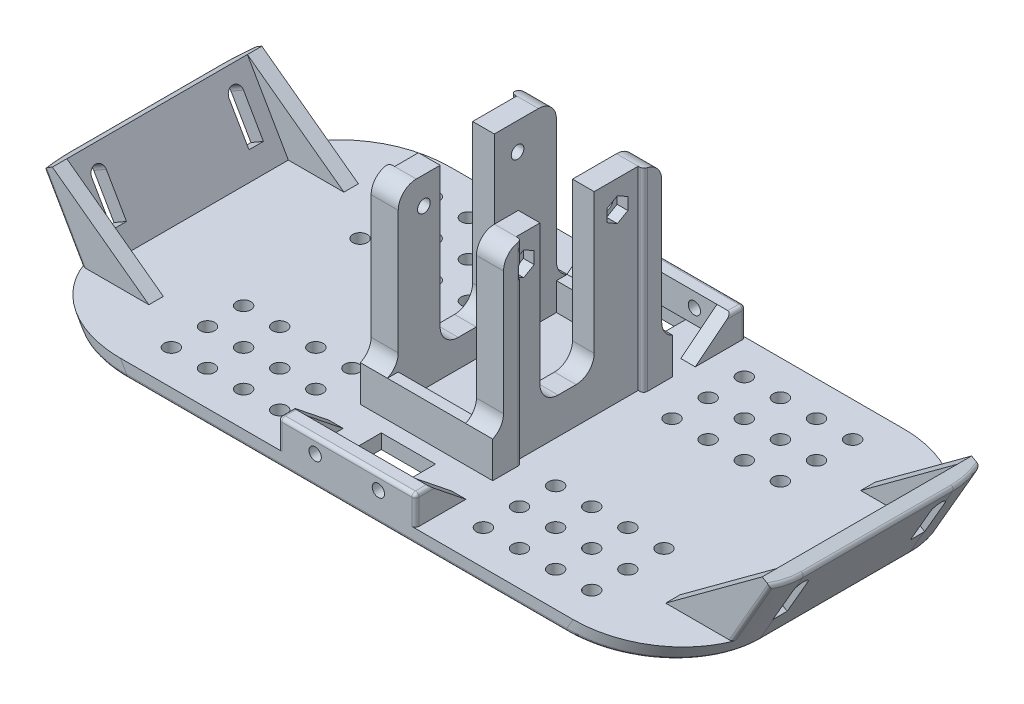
SolidWorks part; units mm, degrees
ref_plane "前视基准面" through (0, 0, 0) normal (0, 0, 1) x (1, 0, 0)
ref_plane "上视基准面" through (0, 0, 0) normal (0, 1, 0) x (1, 0, 0)
ref_plane "右视基准面" through (0, 0, 0) normal (1, 0, 0) x (0, 0, -1)
sketch "草图1" plane through (0, 0, 0) normal (0, 0, 1) x (1, 0, 0)
  line L0 (0, 38.1234) -> (0, -105.8805) construction
  line L1 (-100, -37.7728) -> (100, -37.7728)
  line L2 (-100, -37.7728) -> (-100, -33.7728)
  line L3 (-100, -33.7728) -> (100, -33.7728)
  line L4 (100, -37.7728) -> (100, -33.7728)
  circle A1 centre (-8.75, -29.7728) radius 1.7 construction
  dimension "D1" = 4
  dimension "D2" = 4
  dimension "D3" = 200
extrude "凸台-拉伸1" add sketch "草图1" against normal blind 45.75
sketch "草图2" plane through (0, 0, -45.75) normal (0, 0, -1) x (-1, 0, 0)
  line L0 (0, 0) -> (0, -33.7728) construction
  line L1 (-100, -33.7728) -> (100, -33.7728) construction
  line L3 (-15, -25.7728) -> (15, -25.7728)
  line L4 (-15, -25.7728) -> (-15, -33.7728)
  line L5 (-15, -33.7728) -> (15, -33.7728)
  line L6 (15, -25.7728) -> (15, -33.7728)
  circle A0 centre (-8.75, -29.7728) radius 1.7
  circle A1 centre (8.75, -29.7728) radius 1.7
  dimension "D1" = 30
  dimension "D2" = 8
extrude "凸台-拉伸2" add sketch "草图2" against normal blind 4
sketch "草图3" plane through (-15, 0, 0) normal (-1, 0, 0) x (0, 0, 1)
  line L0 (-41.75, -25.7728) -> (-31.75, -33.7728)
  line L1 (-45.75, -33.7728) -> (0, -33.7728) construction
  line L2 (-31.75, -33.7728) -> (-41.75, -33.7728)
  line L4 (-45.75, -25.7728) -> (-45.75, -33.7728)
  line L5 (-45.75, -33.7728) -> (-41.75, -33.7728)
  line L6 (-41.75, -33.7728) -> (-41.75, -25.7728)
  line L7 (-41.75, -25.7728) -> (-45.75, -25.7728)
  line L8 (-45.75, -25.7728) -> (-45.75, -33.7728)
  line L9 (-45.75, -33.7728) -> (-41.75, -33.7728)
  line L11 (-41.75, -25.7728) -> (-45.75, -25.7728)
  dimension "D2" = 10
  dimension "D1" = 0
extrude "凸台-拉伸3" add sketch "草图3" along normal blind 4
sketch "草图4" plane through (15, 0, 0) normal (1, 0, 0) x (0, 0, -1)
  line L5 (41.75, -25.7728) -> (31.75, -33.7728)
  line L6 (31.75, -33.7728) -> (41.75, -33.7728)
  line L7 (41.75, -33.7728) -> (45.75, -33.7728)
  line L8 (45.75, -33.7728) -> (45.75, -25.7728)
  line L9 (45.75, -25.7728) -> (41.75, -25.7728)
  line L10 (41.75, -25.7728) -> (31.75, -33.7728)
  line L11 (31.75, -33.7728) -> (41.75, -33.7728)
  line L12 (41.75, -33.7728) -> (45.75, -33.7728)
  line L13 (45.75, -33.7728) -> (45.75, -25.7728)
  line L14 (45.75, -25.7728) -> (41.75, -25.7728)
  dimension "D1" = 0
extrude "凸台-拉伸4" add sketch "草图4" along normal blind 4
sketch "草图5" plane through (0, 0, -45.75) normal (0, 0, -1) x (-1, 0, 0)
  line L0 (97.0733, -24.1862) -> (87.6203, -40.5592)
  line L3 (87.6203, -40.5592) -> (102.5438, -40.5696)
  line L4 (102.5438, -40.5696) -> (102.5438, -24.1862)
  line L5 (102.5438, -24.1862) -> (97.0733, -24.1862)
  line L6 (0, 27.5212) -> (0, 0) construction
  line L7 (-102.5438, -24.1862) -> (-97.0733, -24.1862)
  line L8 (-102.5438, -40.5696) -> (-102.5438, -24.1862)
  line L9 (-87.6203, -40.5592) -> (-102.5438, -40.5696)
  line L10 (-97.0733, -24.1862) -> (-87.6203, -40.5592)
extrude "切除-拉伸1" cut sketch "草图5" against normal blind 64.8
mirror "镜向1" about plane through (0, 0, 0) normal (0, 0, -1)
sketch "草图6" plane through (-83.2779, -48.0805, 0) normal (-0.866, -0.5, 0) x (0, 0, 1)
  line L0 (0, 0) -> (0, 32.6716) construction
  line L1 (-45.75, 11.9023) -> (45.75, 11.9023) construction
  line L2 (-25, 11.9023) -> (25, 11.9023)
  line L3 (-25, 11.9023) -> (-25, 36.9023)
  line L4 (-25, 36.9023) -> (25, 36.9023)
  line L5 (25, 11.9023) -> (25, 36.9023)
  line L6 (19, 31.0422) -> (-23.578, 31.0422) construction
  line L8 (-21, 31.0422) -> (-21, 20.0192)
  line L9 (-21, 20.0192) -> (-17, 20.0192)
  line L10 (-17, 31.0422) -> (-17, 20.0192)
  line L12 (17, 31.0422) -> (17, 19.8442)
  line L13 (17, 19.8442) -> (21, 19.8442)
  line L14 (21, 31.0422) -> (21, 19.8442)
  arc A0 (-17, 31.0422) -> (-21, 31.0422) centre (-19, 31.0422) ccw
  arc A1 (21, 31.0422) -> (17, 31.0422) centre (19, 31.0422) ccw
  dimension "D1" = 50
  dimension "D2" = 25
extrude "凸台-拉伸5" add sketch "草图6" against normal blind 4
sketch "草图7" plane through (0, 0, 25) normal (0, 0, 1) x (1, 0, 0)
  line L0 (-91.5384, -33.7728) -> (-101.729, -16.1222)
  line L2 (-101.729, -16.1222) -> (-98.2649, -14.1222)
  line L3 (-98.2649, -14.1222) -> (-101.729, -16.1222) construction
  line L4 (-86.9196, -33.7728) -> (-98.2649, -14.1222) construction
  line L5 (-98.2649, -14.1222) -> (-71.5384, -33.7728)
  line L6 (-19, -33.7728) -> (-91.5384, -33.7728) construction
  line L7 (-71.5384, -33.7728) -> (-91.5384, -33.7728)
  dimension "D1" = 20
extrude "凸台-拉伸6" add sketch "草图7" along normal blind 4
sketch "草图8" plane through (0, 0, -25) normal (0, 0, -1) x (-1, 0, 0)
  line L4 (91.5384, -33.7728) -> (101.729, -16.1222)
  line L5 (101.729, -16.1222) -> (98.2649, -14.1222)
  line L6 (98.2649, -14.1222) -> (71.5384, -33.7728)
  line L7 (71.5384, -33.7728) -> (91.5384, -33.7728)
  line L8 (91.5384, -33.7728) -> (101.729, -16.1222)
  line L9 (101.729, -16.1222) -> (98.2649, -14.1222)
  line L10 (98.2649, -14.1222) -> (71.5384, -33.7728)
  line L11 (71.5384, -33.7728) -> (91.5384, -33.7728)
  dimension "D1" = 0
extrude "凸台-拉伸7" add sketch "草图8" along normal blind 4
mirror "镜向2" about plane through (0, 0, 0) normal (1, 0, 0) of "凸台-拉伸7", "凸台-拉伸6", "凸台-拉伸5"
fillet "圆角1" radius 25 4 edges at (90.3837, -35.7728, 45.75) (90.3837, -35.7728, -45.75) (-90.3837, -35.7728, 45.75) (-90.3837, -35.7728, -45.75)
sketch "草图12" plane through (0, -33.7728, 0) normal (0, 1, 0) x (1, 0, 0)
  line L0 (33.5526, 0) -> (-51.6593, 0) construction
  line L1 (-8.6552, -42.532) -> (-8.6552, -27.532)
  line L2 (6.3448, 42.532) -> (-8.6552, 42.532)
  line L3 (6.3448, 42.532) -> (6.3448, 27.532)
  line L4 (6.3448, 27.532) -> (-8.6552, 27.532)
  line L5 (-8.6552, 42.532) -> (-8.6552, 27.532)
  line L6 (6.3448, -27.532) -> (-8.6552, -27.532)
  line L7 (6.3448, -42.532) -> (6.3448, -27.532)
  line L8 (6.3448, -42.532) -> (-8.6552, -42.532)
  circle A0 centre (58.1968, 36.1191) radius 2
  circle A1 centre (48.1968, 36.1191) radius 2
  circle A2 centre (38.1968, 36.1191) radius 2
  circle A3 centre (28.1968, 36.1191) radius 2
  circle A4 centre (48.1968, 26.1191) radius 2
  circle A5 centre (38.1968, 26.1191) radius 2
  circle A6 centre (28.1968, 26.1191) radius 2
  circle A7 centre (48.1968, 16.1191) radius 2
  circle A8 centre (38.1968, 16.1191) radius 2
  circle A9 centre (28.1968, 16.1191) radius 2
  circle A10 centre (58.1968, 26.1191) radius 2
  circle A11 centre (58.1968, 16.1191) radius 2
  circle A12 centre (-58.1968, 16.1191) radius 2
  circle A13 centre (-58.1968, 26.1191) radius 2
  circle A14 centre (-28.1968, 16.1191) radius 2
  circle A15 centre (-38.1968, 16.1191) radius 2
  circle A16 centre (-48.1968, 16.1191) radius 2
  circle A17 centre (-28.1968, 26.1191) radius 2
  circle A18 centre (-38.1968, 26.1191) radius 2
  circle A19 centre (-48.1968, 26.1191) radius 2
  circle A20 centre (-28.1968, 36.1191) radius 2
  circle A21 centre (-38.1968, 36.1191) radius 2
  circle A22 centre (-48.1968, 36.1191) radius 2
  circle A23 centre (-58.1968, 36.1191) radius 2
  circle A24 centre (-58.1968, -36.1191) radius 2
  circle A25 centre (-48.1968, -36.1191) radius 2
  circle A26 centre (-38.1968, -36.1191) radius 2
  circle A27 centre (-28.1968, -36.1191) radius 2
  circle A28 centre (-48.1968, -26.1191) radius 2
  circle A29 centre (-38.1968, -26.1191) radius 2
  circle A30 centre (-28.1968, -26.1191) radius 2
  circle A31 centre (-48.1968, -16.1191) radius 2
  circle A32 centre (-38.1968, -16.1191) radius 2
  circle A33 centre (-28.1968, -16.1191) radius 2
  circle A34 centre (-58.1968, -26.1191) radius 2
  circle A35 centre (-58.1968, -16.1191) radius 2
  circle A36 centre (58.1968, -16.1191) radius 2
  circle A37 centre (58.1968, -26.1191) radius 2
  circle A38 centre (28.1968, -16.1191) radius 2
  circle A39 centre (38.1968, -16.1191) radius 2
  circle A40 centre (48.1968, -16.1191) radius 2
  circle A41 centre (28.1968, -26.1191) radius 2
  circle A42 centre (38.1968, -26.1191) radius 2
  circle A43 centre (48.1968, -26.1191) radius 2
  circle A44 centre (28.1968, -36.1191) radius 2
  circle A45 centre (38.1968, -36.1191) radius 2
  circle A46 centre (48.1968, -36.1191) radius 2
  circle A47 centre (58.1968, -36.1191) radius 2
  dimension "D1" = 4
  dimension "D3" = 4
  dimension "D2" = 3
extrude "切除-拉伸5" cut sketch "草图12" against normal blind 13
sketch "草图14" plane through (0, -33.7728, 0) normal (0, 1, 0) x (1, 0, 0)
  line L0 (-10.9, -20.6) -> (10.75, -20.6)
  line L1 (-13.9, -23.6) -> (13.75, -23.6)
  line L2 (13.75, -23.6) -> (13.75, 26.2)
  line L3 (-13.9, 26.2) -> (13.75, 26.2)
  line L4 (-13.9, -23.6) -> (-13.9, 26.2)
  line L5 (10.75, -20.6) -> (10.75, 23.2)
  line L6 (-10.9, 23.2) -> (10.75, 23.2)
  line L7 (-10.9, -20.6) -> (-10.9, 23.2)
  dimension "D1" = 3
extrude "凸台-拉伸8" add sketch "草图14" along normal blind 10
sketch "草图15" plane through (0, -33.7728, 0) normal (0, 1, 0) x (1, 0, 0)
  line L4 (-10.9, 23.2) -> (-10.9, -20.6)
  line L5 (-10.9, -20.6) -> (10.75, -20.6)
  line L6 (10.75, -20.6) -> (10.75, 23.2)
  line L7 (10.75, 23.2) -> (-10.9, 23.2)
  line L8 (-10.9, 23.2) -> (-10.9, -20.6)
  line L9 (-10.9, -20.6) -> (10.75, -20.6)
  line L10 (10.75, -20.6) -> (10.75, 23.2)
  line L11 (10.75, 23.2) -> (-10.9, 23.2)
  dimension "D1" = 0
extrude "凸台-拉伸9" add sketch "草图15" along normal blind 2.35
sketch "草图18" plane through (-13.9, 0, 0) normal (-1, 0, 0) x (0, 0, 1)
  line L0 (0, 20.1614) -> (0, 0) construction
  line L1 (-18, 17) -> (-9, 17)
  line L2 (-18, 17) -> (-18, -25.0647)
  line L3 (-18, -25.0647) -> (-9, -25.0647)
  line L5 (9, 17) -> (9, -25.0647)
  line L6 (18, -25.0647) -> (9, -25.0647)
  line L7 (18, 17) -> (18, -25.0647)
  line L8 (18, 17) -> (9, 17)
  line L9 (-9, 17) -> (-6, 17)
  line L10 (-6, 17) -> (-6, -25.0647)
  line L11 (-9, -25.0647) -> (-6, -25.0647)
  dimension "D1" = 3
  dimension "D2" = 9
  dimension "D3" = 25.0647
  dimension "D4" = 17
extrude "凸台-拉伸10" add sketch "草图18" against normal blind 3
sketch "草图19" plane through (13.75, 0, 0) normal (1, 0, 0) x (0, 0, -1)
  line L4 (-9, -25.0647) -> (-9, 17)
  line L5 (-18, -25.0647) -> (-9, -25.0647)
  line L6 (-18, 17) -> (-18, -25.0647)
  line L7 (-9, 17) -> (-18, 17)
  line L8 (-9, -25.0647) -> (-9, 17)
  line L9 (-18, -25.0647) -> (-9, -25.0647)
  line L10 (-18, 17) -> (-18, -25.0647)
  line L11 (-9, 17) -> (-18, 17)
  line L12 (18, 17) -> (9, 17)
  line L13 (9, 17) -> (6, 17)
  line L14 (9, -25.0647) -> (18, -25.0647)
  line L15 (18, -25.0647) -> (18, 17)
  line L16 (18, 17) -> (9, 17)
  line L17 (9, 17) -> (6, 17)
  line L18 (9, -25.0647) -> (18, -25.0647)
  line L19 (18, -25.0647) -> (18, 17)
  line L22 (6, 17) -> (6, -25.0647)
  line L23 (6, 17) -> (6, -25.0647)
  line L24 (6, -25.0647) -> (9, -25.0647)
  line L25 (6, -25.0647) -> (9, -25.0647)
  dimension "D1" = 0
  dimension "D2" = 0
extrude "凸台-拉伸11" add sketch "草图19" against normal blind 3
sketch "草图20" plane through (-13.9, 0, 0) normal (-1, 0, 0) x (0, 0, 1)
  line L0 (0, 21.6193) -> (0, 0) construction
  line L1 (-12.4377, 17) -> (-12.4377, 20.1612) construction
  line L2 (-6, 17) -> (-18, 17) construction
  circle A0 centre (-12.4377, 12.4612) radius 1.75
  circle A1 centre (13.5, 12.4612) radius 1.75
extrude "切除-拉伸6" cut sketch "草图20" against normal blind 38
fillet "圆角3" [suppressed] radius 3
sketch "草图21" plane through (0, 17, 0) normal (0, 1, 0) x (1, 0, 0)
  line L0 (13.75, 6) -> (13.75, 18) construction
  line L1 (13.75, 18) -> (10.75, 18) construction
  line L2 (10.75, 18) -> (10.75, 6) construction
  line L3 (10.75, 6) -> (13.75, 6) construction
  line L4 (-13.9, 18) -> (-13.9, 6)
  line L5 (-13.9, 6) -> (-10.9, 6)
  line L6 (-10.9, 6) -> (-10.9, 18)
  line L7 (-10.9, 18) -> (-13.9, 18)
  line L8 (-13.9, 18) -> (-13.9, 6)
  line L9 (-13.9, 6) -> (-10.9, 6)
  line L10 (-10.9, 6) -> (-10.9, 18)
  line L11 (-10.9, 18) -> (-13.9, 18)
  line L12 (-13.9, -9) -> (-13.9, -18) construction
  line L13 (-13.9, -18) -> (-10.9, -18) construction
  line L14 (-10.9, -18) -> (-10.9, -9) construction
  line L15 (-10.9, -9) -> (-13.9, -9) construction
  line L16 (13.75, -18) -> (13.75, -9) construction
  line L17 (13.75, -9) -> (10.75, -9) construction
  line L18 (10.75, -9) -> (10.75, -18) construction
  line L19 (10.75, -18) -> (13.75, -18) construction
  line L20 (13.75, 6) -> (13.75, 18)
  line L21 (13.75, 18) -> (10.75, 18)
  line L22 (10.75, 18) -> (10.75, 6)
  line L23 (10.75, 6) -> (13.75, 6)
  line L24 (-13.9, -9) -> (-13.9, -18)
  line L25 (-13.9, -18) -> (-10.9, -18)
  line L26 (-10.9, -18) -> (-10.9, -9)
  line L27 (-10.9, -9) -> (-13.9, -9)
  line L28 (13.75, -18) -> (13.75, -9)
  line L29 (13.75, -9) -> (10.75, -9)
  line L30 (10.75, -9) -> (10.75, -18)
  line L31 (10.75, -18) -> (13.75, -18)
  dimension "D1" = 0
extrude "凸台-拉伸12" add sketch "草图21" along normal blind 3
sketch "草图22" plane through (0, -23.7728, 0) normal (0, 1, 0) x (1, 0, 0)
  line L8 (10.75, 23.2) -> (10.75, 18)
  line L9 (10.75, 18) -> (13.75, 18)
  line L10 (13.75, 18) -> (13.75, 26.2)
  line L11 (13.75, 26.2) -> (-13.9, 26.2)
  line L12 (-13.9, 26.2) -> (-13.9, 18)
  line L13 (-13.9, 18) -> (-10.9, 18)
  line L14 (-10.9, 18) -> (-10.9, 23.2)
  line L15 (-10.9, 23.2) -> (10.75, 23.2)
  line L16 (10.75, 23.2) -> (10.75, 18)
  line L17 (10.75, 18) -> (13.75, 18)
  line L18 (13.75, 18) -> (13.75, 23.2)
  line L20 (-13.9, 23.2) -> (-13.9, 18)
  line L21 (-13.9, 18) -> (-10.9, 18)
  line L22 (-10.9, 18) -> (-10.9, 23.2)
  line L23 (10.75, 23.2) -> (13.75, 23.2)
  line L24 (13.75, -23.6) -> (13.75, -18)
  line L25 (13.75, -18) -> (10.75, -18)
  line L26 (10.75, -18) -> (10.75, -20.6)
  line L27 (10.75, -20.6) -> (-10.9, -20.6)
  line L28 (-10.9, -20.6) -> (-10.9, -18)
  line L29 (-10.9, -18) -> (-13.9, -18)
  line L30 (-13.9, -18) -> (-13.9, -23.6)
  line L31 (-13.9, -23.6) -> (13.75, -23.6)
  line L32 (13.75, -20.6) -> (13.75, -18)
  line L33 (13.75, -18) -> (10.75, -18)
  line L34 (10.75, -18) -> (10.75, -20.6)
  line L35 (-10.9, 23.2) -> (-13.9, 23.2)
  line L36 (-10.9, -20.6) -> (-10.9, -18)
  line L37 (-10.9, -18) -> (-13.9, -18)
  line L38 (-13.9, -18) -> (-13.9, -20.6)
  line L40 (-10.9, -20.6) -> (-13.9, -20.6)
  line L41 (10.75, -20.6) -> (13.75, -20.6)
  dimension "D1" = 0
  dimension "D2" = 0
extrude "凸台-拉伸13" add sketch "草图22" along normal up to surface (43.7728 mm away)
fillet "圆角2" radius 5 12 edges at (-12.4, -23.7728, 9) (12.25, -23.7728, 9) (12.25, -23.7728, -6) (-12.4, -23.7728, -6) (12.25, -23.7728, 20.6) (-12.4, -23.7728, 20.6) (12.25, -23.7728, -23.2) (-12.4, -23.7728, -23.2) (12.25, 20, 20.6) (-12.4, 20, 20.6) (12.25, 20, -23.2) (-12.4, 20, -23.2)
sketch "草图23" plane through (13.75, 0, 0) normal (1, 0, 0) x (0, 0, -1)
  line L10 (-9, 20) -> (-15.6, 20)
  line L11 (-20.6, 15) -> (-20.6, -19.1902)
  line L12 (-23.6, -23.7728) -> (-23.6, -33.7728)
  line L13 (-23.6, -33.7728) -> (26.2, -33.7728)
  line L14 (26.2, -33.7728) -> (26.2, -23.7728)
  line L15 (23.2, -19.1902) -> (23.2, 15)
  line L16 (18.2, 20) -> (6, 20)
  line L17 (6, 20) -> (6, -18.7728)
  line L18 (1, -23.7728) -> (-4, -23.7728)
  line L19 (-9, -18.7728) -> (-9, 20)
  line L20 (-9, 20) -> (-15.6, 20)
  line L21 (-20.6, 15) -> (-20.6, -19.1902)
  line L22 (-23.6, -23.7728) -> (-23.6, -33.7728)
  line L23 (-23.6, -33.7728) -> (26.2, -33.7728)
  line L24 (26.2, -33.7728) -> (26.2, -23.7728)
  line L25 (23.2, -19.1902) -> (23.2, 15)
  line L26 (18.2, 20) -> (6, 20)
  line L27 (6, 20) -> (6, -18.7728)
  line L28 (1, -23.7728) -> (-4, -23.7728)
  line L29 (-9, -18.7728) -> (-9, 20)
  circle A0 centre (-13.5, 12.4612) radius 1.75 construction
  circle A1 centre (-13.5, 12.4612) radius 1.75
  circle A2 centre (12.4377, 12.4612) radius 1.75 construction
  circle A3 centre (12.4377, 12.4612) radius 1.75
  arc A6 (-15.6, 20) -> (-20.6, 15) centre (-15.6, 15) ccw
  arc A7 (-23.6, -23.7728) -> (-20.6, -19.1902) centre (-25.6, -19.1902) ccw
  arc A8 (23.2, -19.1902) -> (26.2, -23.7728) centre (28.2, -19.1902) ccw
  arc A9 (23.2, 15) -> (18.2, 20) centre (18.2, 15) ccw
  arc A10 (1, -23.7728) -> (6, -18.7728) centre (1, -18.7728) ccw
  arc A11 (-9, -18.7728) -> (-4, -23.7728) centre (-4, -18.7728) ccw
  arc A12 (-15.6, 20) -> (-20.6, 15) centre (-15.6, 15) ccw
  arc A13 (-23.6, -23.7728) -> (-20.6, -19.1902) centre (-25.6, -19.1902) ccw
  arc A14 (23.2, -19.1902) -> (26.2, -23.7728) centre (28.2, -19.1902) ccw
  arc A15 (23.2, 15) -> (18.2, 20) centre (18.2, 15) ccw
  arc A16 (1, -23.7728) -> (6, -18.7728) centre (1, -18.7728) ccw
  arc A17 (-9, -18.7728) -> (-4, -23.7728) centre (-4, -18.7728) ccw
  dimension "D1" = 0
extrude "凸台-拉伸14" add sketch "草图23" along normal blind 3
sketch "草图24" plane through (-13.9, 0, 0) normal (-1, 0, 0) x (0, 0, 1)
  line L10 (20.6, -19.1902) -> (20.6, 15)
  line L11 (15.6, 20) -> (9, 20)
  line L12 (9, 20) -> (9, -18.7728)
  line L13 (4, -23.7728) -> (-1, -23.7728)
  line L14 (-6, -18.7728) -> (-6, 20)
  line L15 (-6, 20) -> (-18.2, 20)
  line L16 (-23.2, 15) -> (-23.2, -19.1902)
  line L17 (-26.2, -23.7728) -> (-26.2, -33.7728)
  line L18 (-26.2, -33.7728) -> (23.6, -33.7728)
  line L19 (23.6, -33.7728) -> (23.6, -23.7728)
  line L20 (20.6, -19.1902) -> (20.6, 15)
  line L21 (15.6, 20) -> (9, 20)
  line L22 (9, 20) -> (9, -18.7728)
  line L23 (4, -23.7728) -> (-1, -23.7728)
  line L24 (-6, -18.7728) -> (-6, 20)
  line L25 (-6, 20) -> (-18.2, 20)
  line L26 (-23.2, 15) -> (-23.2, -19.1902)
  line L27 (-26.2, -23.7728) -> (-26.2, -33.7728)
  line L28 (-26.2, -33.7728) -> (23.6, -33.7728)
  line L29 (23.6, -33.7728) -> (23.6, -23.7728)
  circle A0 centre (-12.4377, 12.4612) radius 1.75 construction
  circle A1 centre (13.5, 12.4612) radius 1.75 construction
  circle A2 centre (-12.4377, 12.4612) radius 1.75
  circle A3 centre (13.5, 12.4612) radius 1.75
  arc A10 (20.6, 15) -> (15.6, 20) centre (15.6, 15) ccw
  arc A11 (4, -23.7728) -> (9, -18.7728) centre (4, -18.7728) ccw
  arc A12 (-6, -18.7728) -> (-1, -23.7728) centre (-1, -18.7728) ccw
  arc A13 (-18.2, 20) -> (-23.2, 15) centre (-18.2, 15) ccw
  arc A14 (-26.2, -23.7728) -> (-23.2, -19.1902) centre (-28.2, -19.1902) ccw
  arc A15 (20.6, -19.1902) -> (23.6, -23.7728) centre (25.6, -19.1902) ccw
  arc A16 (20.6, 15) -> (15.6, 20) centre (15.6, 15) ccw
  arc A17 (4, -23.7728) -> (9, -18.7728) centre (4, -18.7728) ccw
  arc A18 (-6, -18.7728) -> (-1, -23.7728) centre (-1, -18.7728) ccw
  arc A19 (-18.2, 20) -> (-23.2, 15) centre (-18.2, 15) ccw
  arc A20 (-26.2, -23.7728) -> (-23.2, -19.1902) centre (-28.2, -19.1902) ccw
  arc A21 (20.6, -19.1902) -> (23.6, -23.7728) centre (25.6, -19.1902) ccw
  dimension "D1" = 0
extrude "凸台-拉伸15" add sketch "草图24" along normal blind 3
sketch "草图25" plane through (16.75, 0, 0) normal (1, 0, 0) x (0, 0, -1)
  line L1 (-10.6, 10.7869) -> (-10.6, 14.1355)
  line L2 (-10.6, 14.1355) -> (-13.5, 15.8098)
  line L3 (-13.5, 15.8098) -> (-16.4, 14.1355)
  line L4 (-16.4, 14.1355) -> (-16.4, 10.7869)
  line L5 (-16.4, 10.7869) -> (-13.5, 9.1125)
  line L6 (-13.5, 9.1125) -> (-10.6, 10.7869)
  line L7 (15.3377, 10.7869) -> (15.3377, 14.1355)
  line L8 (15.3377, 14.1355) -> (12.4377, 15.8098)
  line L9 (12.4377, 15.8098) -> (9.5377, 14.1355)
  line L10 (9.5377, 14.1355) -> (9.5377, 10.7869)
  line L11 (9.5377, 10.7869) -> (12.4377, 9.1125)
  line L12 (12.4377, 9.1125) -> (15.3377, 10.7869)
  circle A0 centre (-13.5, 12.4612) radius 2.9 construction
  circle A1 centre (12.4377, 12.4612) radius 2.9 construction
  dimension "D1" = 5.8
  dimension "D2" = 5.8
extrude "切除-拉伸7" cut sketch "草图25" against normal blind 3
sketch "草图26" plane through (-16.9, 0, 0) normal (-1, 0, 0) x (0, 0, 1)
  circle A0 centre (-12.4377, 12.4612) radius 3.75
  circle A1 centre (13.5, 12.4612) radius 3.75
  dimension "D1" = 7.5
  dimension "D2" = 7.5
extrude "切除-拉伸8" cut sketch "草图26" against normal blind 3
sketch "草图27" plane through (-16.9, 0, 0) normal (-1, 0, 0) x (0, 0, 1)
  line L0 (-23.2, 15) -> (-23.2, -19.1902) construction
  line L1 (-26.2, -23.7728) -> (-26.2, -33.7728) construction
  line L2 (-26.2, -33.7728) -> (23.6, -33.7728) construction
  line L3 (-23.2, 15) -> (-23.2, -19.1902)
  line L4 (-26.2, -23.7728) -> (-26.2, -33.7728)
  line L5 (-26.2, -33.7728) -> (-18.2, -33.7728)
  line L6 (-18.2, 20) -> (-18.2, -33.7728)
  line L7 (23.6, -33.7728) -> (23.6, -23.7728) construction
  line L8 (20.6, -19.1902) -> (20.6, 15) construction
  line L9 (23.6, -33.7728) -> (23.6, -23.7728)
  line L10 (20.6, -19.1902) -> (20.6, 15)
  line L11 (15.6, 20) -> (15.6, 15.568)
  line L12 (15.6, -33.7728) -> (23.6, -33.7728)
  line L13 (15.6, 9.3543) -> (15.6, -33.7728)
  arc A0 (-18.2, 20) -> (-23.2, 15) centre (-18.2, 15) ccw construction
  arc A1 (-26.2, -23.7728) -> (-23.2, -19.1902) centre (-28.2, -19.1902) ccw construction
  arc A2 (-18.2, 20) -> (-23.2, 15) centre (-18.2, 15) ccw
  arc A3 (-26.2, -23.7728) -> (-23.2, -19.1902) centre (-28.2, -19.1902) ccw
  arc A4 (20.6, -19.1902) -> (23.6, -23.7728) centre (25.6, -19.1902) ccw construction
  arc A5 (20.6, 15) -> (15.6, 20) centre (15.6, 15) ccw construction
  circle A6 centre (13.5, 12.4612) radius 3.75 construction
  arc A7 (20.6, -19.1902) -> (23.6, -23.7728) centre (25.6, -19.1902) ccw
  arc A8 (20.6, 15) -> (15.6, 20) centre (15.6, 15) ccw
  arc A9 (15.6, 9.3543) -> (15.6, 15.568) centre (13.5, 12.4612) ccw
extrude "凸台-拉伸16" add sketch "草图27" along normal blind 1.5
fillet "圆角4" radius 1 18 edges at (89.229, -37.7728, 0) (101.729, -16.1222, 0) (101.4237, -15.9459, 24.934) (101.4237, -15.9459, -24.934) (95.2187, -24.5974, -29) (0, -37.7728, -45.75) (0, -37.7728, 45.75) (-89.229, -37.7728, 0) (-80.7739, -37.7728, -38.4277) (-80.7739, -37.7728, 38.4277) (80.7739, -37.7728, 38.4277) (80.7739, -37.7728, -38.4277) (95.2187, -24.5974, 29) (-101.729, -16.1222, 0) (-101.4237, -15.9459, -24.934) (-101.4237, -15.9459, 24.934) (-95.2187, -24.5974, 29) (-95.2187, -24.5974, -29)
sketch "草图28" plane through (16.75, 0, 0) normal (1, 0, 0) x (0, 0, -1)
  line L0 (-16.4, 10.7869) -> (-13.5, 9.1125) construction
  line L1 (-16.4, 14.1355) -> (-16.4, 10.7869) construction
  line L2 (-13.5, 15.8098) -> (-16.4, 14.1355) construction
  line L3 (-16.4, 10.7869) -> (-15.6, 10.325)
  line L4 (-16.4, 14.1355) -> (-16.4, 10.7869)
  line L5 (-15.6, 14.5974) -> (-16.4, 14.1355)
  line L6 (-15.6, 20) -> (-15.6, 14.5974)
  line L7 (18.2, 20) -> (18.2, -33.7728)
  line L8 (-10.6, 14.1355) -> (-13.5, 15.8098) construction
  line L9 (-15.6, 10.325) -> (-15.6, -33.7728)
  line L10 (-9, -18.7728) -> (-9, 20)
  line L11 (-9, 20) -> (-15.6, 20)
  line L12 (-20.6, 15) -> (-20.6, -19.1902)
  line L13 (-23.6, -23.7728) -> (-23.6, -33.7728)
  line L14 (-23.6, -33.7728) -> (26.2, -33.7728)
  line L15 (26.2, -33.7728) -> (26.2, -23.7728)
  line L16 (23.2, -19.1902) -> (23.2, 15)
  line L17 (18.2, 20) -> (6, 20)
  line L18 (6, 20) -> (6, -18.7728)
  line L19 (1, -23.7728) -> (-4, -23.7728)
  line L20 (18.2, -33.7728) -> (26.2, -33.7728)
  line L22 (-20.6, 15) -> (-20.6, -19.1902)
  line L23 (-23.6, -23.7728) -> (-23.6, -33.7728)
  line L24 (-23.6, -33.7728) -> (-15.6, -33.7728)
  line L25 (26.2, -33.7728) -> (26.2, -23.7728)
  line L26 (23.2, -19.1902) -> (23.2, 15)
  arc A6 (-15.6, 20) -> (-20.6, 15) centre (-15.6, 15) ccw
  arc A7 (-23.6, -23.7728) -> (-20.6, -19.1902) centre (-25.6, -19.1902) ccw
  arc A8 (23.2, -19.1902) -> (26.2, -23.7728) centre (28.2, -19.1902) ccw
  arc A9 (23.2, 15) -> (18.2, 20) centre (18.2, 15) ccw
  arc A10 (1, -23.7728) -> (6, -18.7728) centre (1, -18.7728) ccw
  arc A11 (-9, -18.7728) -> (-4, -23.7728) centre (-4, -18.7728) ccw
  arc A12 (-15.6, 20) -> (-20.6, 15) centre (-15.6, 15) ccw
  arc A13 (-23.6, -23.7728) -> (-20.6, -19.1902) centre (-25.6, -19.1902) ccw
  arc A14 (23.2, -19.1902) -> (26.2, -23.7728) centre (28.2, -19.1902) ccw
  arc A15 (23.2, 15) -> (18.2, 20) centre (18.2, 15) ccw
  point P15 (-12.05, 14.9726)
  dimension "D1" = 0
extrude "凸台-拉伸17" add sketch "草图28" along normal blind 1.5
fillet "圆角5" radius 1 16 edges at (-19, -29.7728, 45.75) (19, -29.7728, 45.75) (-19, -25.7728, 43.75) (0, -25.7728, 45.75) (19, -25.7728, 43.75) (-19, -25.7728, -43.75) (-19, -29.7728, -45.75) (19, -29.7728, -45.75) (19, -25.7728, -43.75) (0, -25.7728, -45.75) (-18.4, 12.4612, 17.25) (-18.4, 17.784, 15.6) (-18.4, -12.2092, 15.6) (-18.4, -6.8864, -18.2) (18.25, -11.7239, 15.6) (18.25, -6.8864, -18.2)
